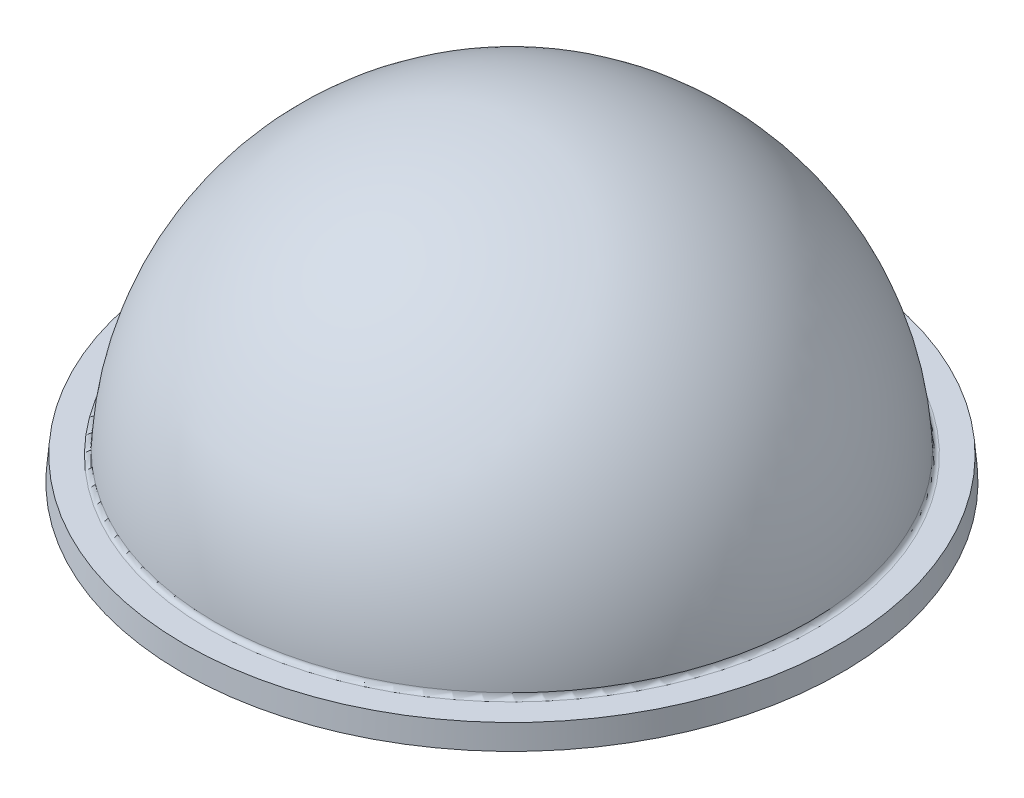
SolidWorks part; units mm, degrees
other "<WTE4-P-DOME-R4>-<Revolve1>"
ref_plane "Front Plane" through (0, 0, 0) normal (0, 0, 1) x (1, 0, 0)
ref_plane "Top Plane" through (0, 0, 0) normal (0, 1, 0) x (1, 0, 0)
ref_plane "Right Plane" through (0, 0, 0) normal (1, 0, 0) x (0, 0, -1)
inserted part "WTE4-P-DOME-R4"
